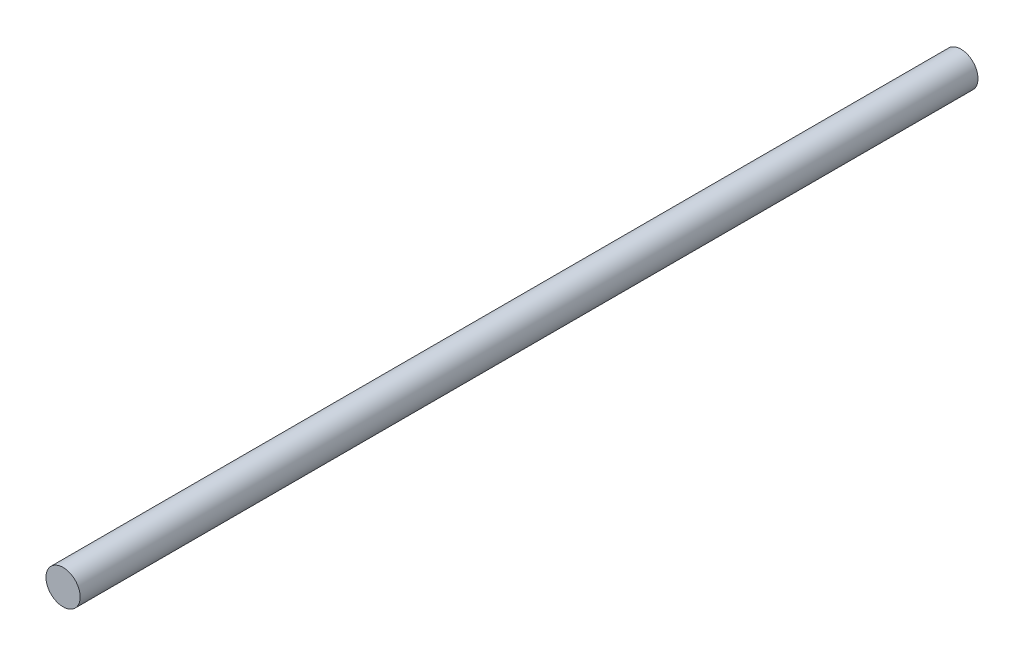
SolidWorks part; units mm, degrees
ref_plane "Face" through (0, 0, 0) normal (0, 0, 1) x (1, 0, 0)
ref_plane "Dessus" through (0, 0, 0) normal (0, 1, 0) x (1, 0, 0)
ref_plane "Droite" through (0, 0, 0) normal (1, 0, 0) x (0, 0, -1)
sketch "Esquisse1" plane through (0, 0, 0) normal (0, 0, 1) x (1, 0, 0)
  circle A0 centre (0, 0) radius 0.4
  dimension "D1" = 0.8
extrude "Extrusion1" add sketch "Esquisse1" along normal blind 21
